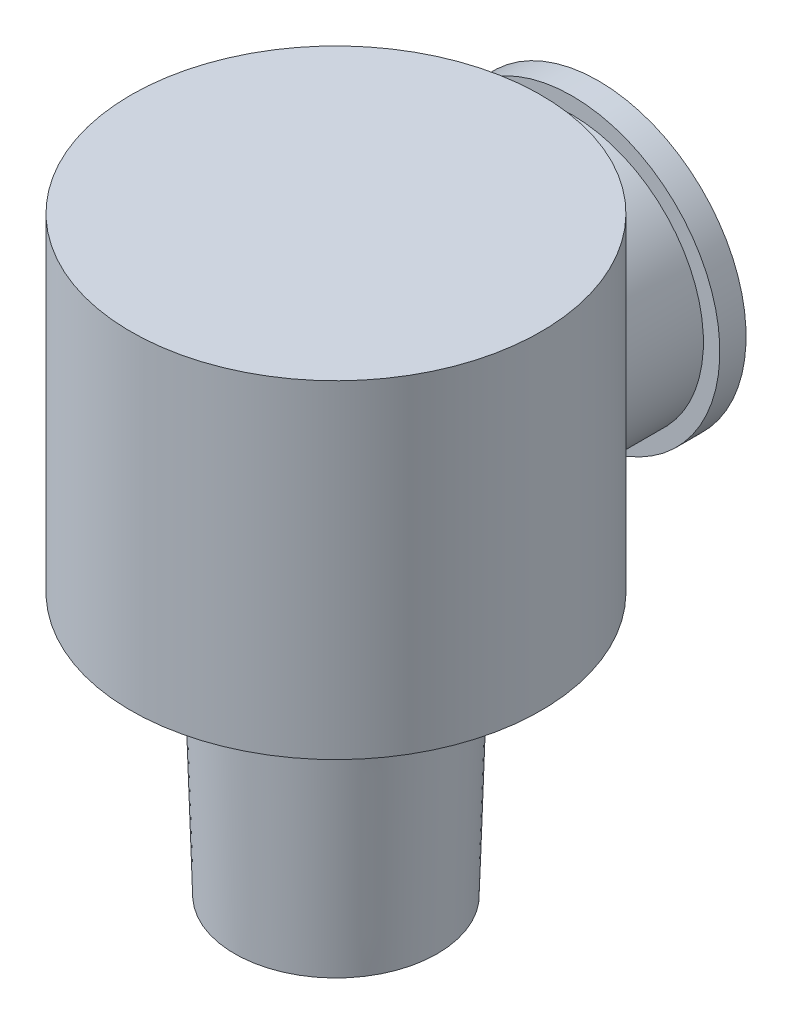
SolidWorks part; units mm, degrees
ref_plane "Front Plane" through (0, 0, 0) normal (0, 0, 1) x (1, 0, 0)
ref_plane "Top Plane" through (0, 0, 0) normal (0, 1, 0) x (1, 0, 0)
ref_plane "Right Plane" through (0, 0, 0) normal (1, 0, 0) x (0, 0, -1)
sketch "Sketch1" plane through (0, 0, 0) normal (0, 0, 1) x (1, 0, 0)
  line L0 (5.207, 0) -> (4.903, -10.3188)
  line L1 (4.903, -10.3188) -> (0, -10.3188)
  line L2 (0, -10.3188) -> (0, 18.2563)
  line L3 (0, 18.2563) -> (9.9219, 18.2563)
  line L4 (9.9219, 18.2563) -> (9.9219, 2.3813)
  line L5 (9.9219, 2.3813) -> (5.207, 2.3812)
  line L6 (5.207, 2.3812) -> (5.207, 0)
  line L7 (0, -10.3188) -> (0, -47.4262) construction
  dimension "D1" = 10.414
  dimension "D2" = 1.688
  dimension "D3" = 10.3187
  dimension "D4" = 2.3813
  dimension "D5" = 19.8438
  dimension "D6" = 15.875
revolve "Revolve1" add sketch "Sketch1" angle 360 about L7
sketch "Sketch2" plane through (0, 0, 0) normal (1, 0, 0) x (0, 0, -1)
  line L0 (0, 10.3187) -> (12.7, 10.3187)
  line L1 (12.7, 10.3187) -> (12.7, 17.4625)
  line L2 (12.7, 17.4625) -> (11.43, 17.4625)
  line L3 (0, 16.6687) -> (0, 10.3187)
  line L4 (12.7, 10.3187) -> (20.9502, 10.3187) construction
  line L5 (11.43, 17.4625) -> (11.43, 16.6687)
  line L6 (11.43, 16.6687) -> (0, 16.6687)
  dimension "D1" = 10.3187
  dimension "D2" = 14.2875
  dimension "D3" = 12.7
  dimension "D4" = 0.7937
  dimension "D5" = 1.27
revolve "Revolve2" add sketch "Sketch2" angle 360 about L4
hole_wizard "3/8 (0.375) Diameter Hole1" positions "Sketch5" profile "Sketch4" hole size "3/8" standard "Example Inch"
sketch "Sketch5" plane through (0, 0, -12.7) normal (0, 0, -1) x (-1, 0, 0)
  point P0 (0, 10.3187)
sketch "Sketch4" plane through (0, 10.3187, -12.7) normal (1, 0, 0) x (0, 1, 0)
  line L0 (0, 0) -> (0, 18.7366)
  line L1 (0, 18.7366) -> (4.7625, 15.875)
  line L2 (4.7625, 15.875) -> (4.7625, 0)
  line L5 (4.7625, 0) -> (0, 0)
  line L10 (0, 18.7366) -> (-4.7625, 15.875) construction
  line L11 (0, -6.35) -> (0, 107.95) construction
  dimension "Hole Dia." = 9.525
  dimension "Hole Depth" = 15.875
  dimension "Drill Angle" = 118
hole_wizard "5/16 (0.3125) Diameter Hole1" positions "Sketch8" profile "Sketch7" hole size "5/16" standard "Example Inch"
sketch "Sketch8" plane through (0, -10.3188, 0) normal (0, -1, 0) x (1, 0, 0)
  point P0 (0, 0)
sketch "Sketch7" plane through (0, -10.3188, 0) normal (1, 0, 0) x (0, 0, -1)
  line L0 (0, 0) -> (0, 24.6097)
  line L1 (0, 24.6097) -> (3.9687, 22.225)
  line L2 (3.9687, 22.225) -> (3.9687, 0)
  line L5 (3.9687, 0) -> (0, 0)
  line L10 (0, 24.6097) -> (-3.9688, 22.225) construction
  line L11 (0, -6.35) -> (0, 107.95) construction
  dimension "Hole Dia." = 7.9375
  dimension "Hole Depth" = 22.225
  dimension "Drill Angle" = 118
